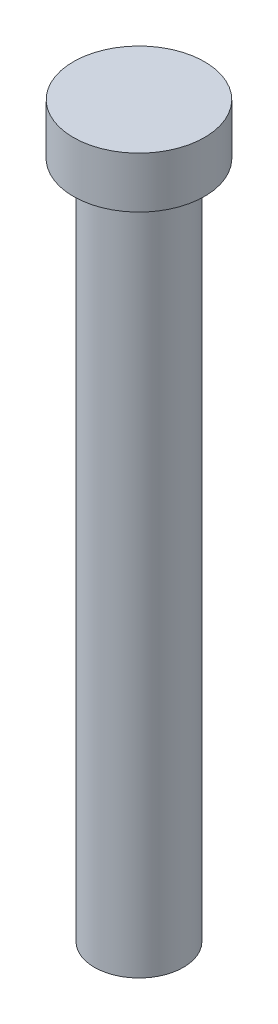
SolidWorks part; units mm, degrees
ref_plane "Front Plane" through (0, 0, 0) normal (0, 0, 1) x (1, 0, 0)
ref_plane "Top Plane" through (0, 0, 0) normal (0, 1, 0) x (1, 0, 0)
ref_plane "Right Plane" through (0, 0, 0) normal (1, 0, 0) x (0, 0, -1)
sketch "PinDia" plane through (0, 0, 0) normal (0, 1, 0) x (1, 0, 0)
  circle A0 centre (0, 0) radius 6.1
  dimension "D1" = 12.2
extrude "Length" add sketch "PinDia" against normal blind 100
sketch "HeadDia" plane through (0, 0, 0) normal (0, 1, 0) x (1, 0, 0)
  circle A0 centre (0, 0) radius 9
  dimension "D1" = 18
extrude "HeadThickness" add sketch "HeadDia" against normal blind 7
fillet "Fillet1" radius 0.8 1 edges at (0, -7, 6.1)
